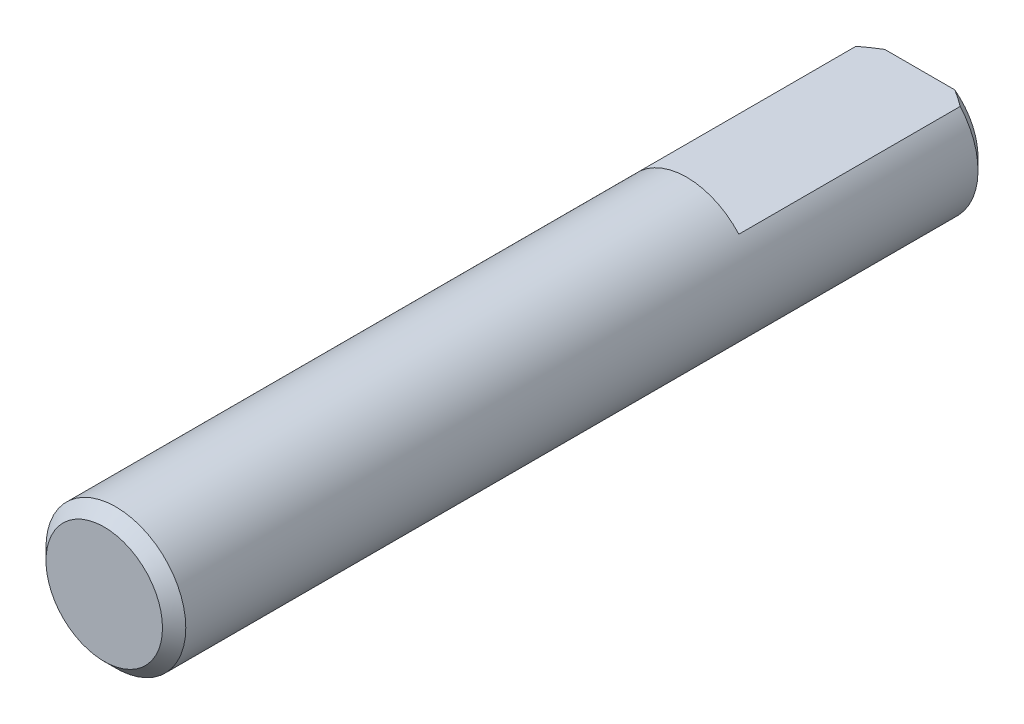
SolidWorks part; units mm, degrees
ref_plane "FACE" through (0, 0, 0) normal (0, 0, 1) x (1, 0, 0)
ref_plane "DESSUS" through (0, 0, 0) normal (0, 1, 0) x (1, 0, 0)
ref_plane "GAUCHE" through (0, 0, 0) normal (1, 0, 0) x (0, 0, -1)
sketch "Esquisse1" plane through (0, 0, 0) normal (0, 0, 1) x (1, 0, 0)
  circle A0 centre (0, 0) radius 3
  dimension "D1" = 6
extrude "Base-Extrusion" add sketch "Esquisse1" along normal blind 35
sketch "Esquisse2" plane through (0, 0, 0) normal (0, 0, -1) x (-1, 0, 0)
  line L0 (-2.2361, 2) -> (2.2361, 2)
  circle A0 centre (0, 0) radius 3 construction
  arc A1 (2.2361, 2) -> (-2.2361, 2) centre (0, 0) ccw
  dimension "D1" = 2
extrude "Enlèv. mat.-Extru.1" cut sketch "Esquisse2" against normal blind 10
chamfer "Chanfrein1" distance 0.5 angle 45
